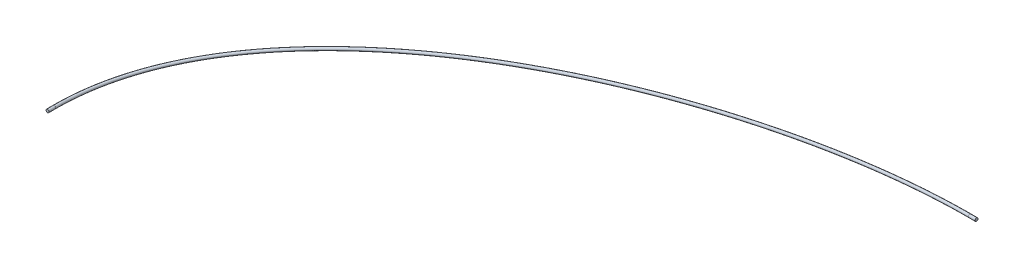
SolidWorks part; units mm, degrees
ref_plane "Front Plane" through (0, 0, 0) normal (0, 0, 1) x (1, 0, 0)
ref_plane "Top Plane" through (0, 0, 0) normal (0, 1, 0) x (1, 0, 0)
ref_plane "Right Plane" through (0, 0, 0) normal (1, 0, 0) x (0, 0, -1)
sketch3d "3DSketch1"
  line L0 (365.887, 107.95, -135.9) -> (358.887, 107.95, -135.9) construction
  line L1 (-254, 76.2, 222.387) -> (-254, 76.2, 215.387) construction
  line L2 (365.887, 107.95, -135.9) -> (358.887, 107.95, -135.9)
  line L3 (-254, 76.2, 222.387) -> (-254, 76.2, 215.387)
  spline S0 degree 3 poles (1385.1574, 234.2865, 1301.162) (-3085.1889, -212.9066, -431.9748) (3562.2872, 525.7132, -526.7386) (-1397.9443, -344.0591, 637.5247) knots -0.998256 -0.998256 -0.998256 -0.998256 2.532179 2.532179 2.532179 2.532179 only from (-254, 76.2, 215.387) to (358.887, 107.95, -135.9) construction
  spline S1 degree 3 poles (-254, 76.2, 215.387) (-254, 76.2, -21.678) (122.4461, 107.95, -135.9) (358.887, 107.95, -135.9) knots 0 0 0 0 1 1 1 1
ref_plane "Plane1" through (365.887, 107.95, -135.9) normal (-1, 0, 0) x (0, 0, 1)
sketch "PipeSketch" plane through (365.887, 107.95, -135.9) normal (-1, 0, 0) x (0, 0, 1)
  circle A0 centre (0, 0) radius 1.5875
  dimension "OuterDiameter" = 3.175
sweep "Cable_1" add profiles "PipeSketch" path "3DSketch1"
